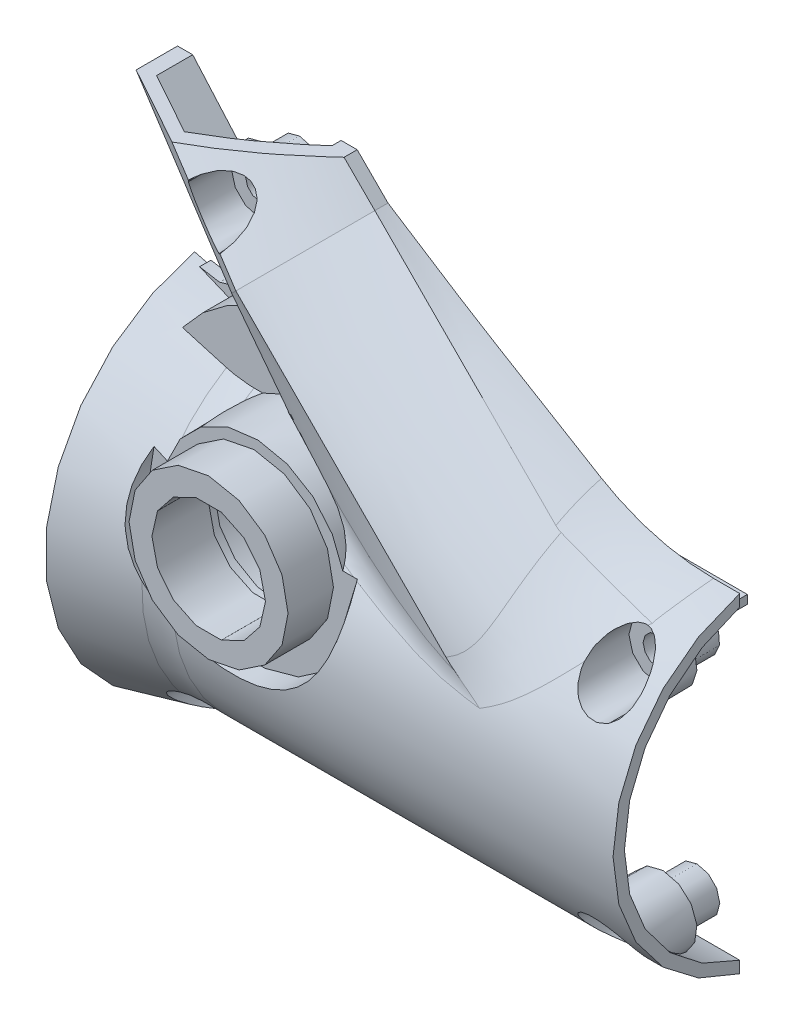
SolidWorks part; units mm, degrees
ref_plane "Plan1" through (0, 0, 0) normal (0, 0, 1) x (1, 0, 0)
ref_plane "Plan2" through (0, 0, 0) normal (0, 1, 0) x (1, 0, 0)
ref_plane "Plan3" through (0, 0, 0) normal (1, 0, 0) x (0, 0, -1)
sketch "Esquisse1" plane through (0, 0, 0) normal (0, 1, 0) x (1, 0, 0)
  line L0 (-80, -50) -> (-80, 50) construction
ref_plane "Plan5" through (-40, 40, 0) normal (-0.7071, 0.7071, 0) x (0, 0, 1)
ref_plane "Plan6" through (-61.2132, 61.2132, 0) normal (-0.7071, 0.7071, 0) x (0, 0, 1)
sketch "Esquisse2" plane through (-61.2132, 61.2132, 0) normal (-0.7071, 0.7071, 0) x (0, 0, 1)
  line L0 (-2.8446, 83.5777) -> (-12.8446, 83.5777)
  line L1 (-1.8446, 73.3764) -> (-13.8446, 73.3764)
  line L2 (-13.8446, 73.3764) -> (-15.3403, 75.977)
  line L3 (-15.3403, 75.977) -> (-12.8446, 83.5777)
  line L4 (-1.8446, 73.3764) -> (-0.3489, 75.977)
  line L5 (-0.3489, 75.977) -> (-2.8446, 83.5777)
  line L6 (-2.8446, 83.5777) -> (-13.8446, 73.3764) construction
  line L7 (-12.8446, 83.5777) -> (-1.8446, 73.3764) construction
  dimension "D1" = 12
  dimension "D2" = 10
  dimension "D3" = 8
  dimension "D4" = 3
  dimension "D5" = 8
  dimension "D6" = 3
sketch "Esquisse3" plane through (-40, 40, 0) normal (-0.7071, 0.7071, 0) x (0, 0, 1)
  line L0 (-2.8446, 83.5777) -> (-12.8446, 83.5777)
  line L1 (-12.8446, 83.5777) -> (-21.218, 78.1109)
  line L2 (-2.8446, 83.5777) -> (5.5288, 78.1109)
  line L3 (5.5288, 78.1109) -> (1.1554, 71.4122)
  line L4 (-21.218, 78.1109) -> (-16.8446, 71.4122)
  line L5 (-16.8446, 71.4122) -> (1.1554, 71.4122)
  line L6 (-2.8446, 83.5777) -> (-16.8446, 71.4122) construction
  line L7 (-12.8446, 83.5777) -> (1.1554, 71.4122) construction
  dimension "D1" = 10
  dimension "D2" = 10
  dimension "D3" = 8
  dimension "D4" = 8
  dimension "D5" = 18
loft "Base-Lissage" add profiles "Esquisse3", "Esquisse2"
ref_plane "Plan7" through (50.07, 0, 0) normal (1, 0, 0) x (0, 0, -1)
ref_plane "Plan8" through (0.07, 0, 0) normal (1, 0, 0) x (0, 0, -1)
sketch "Esquisse5" plane through (0.07, 0, 0) normal (1, 0, 0) x (0, 0, -1)
  circle A0 centre (7.8446, 70.3116) radius 17.5
ref_plane "Plan9" through (-15.2513, 15.2513, 0) normal (-0.7071, 0.7071, 0) x (0, 0, 1)
ref_plane "Plan10" through (10.07, 0, 0) normal (1, 0, 0) x (0, 0, -1)
sketch "Esquisse9" plane through (10.07, 0, 0) normal (1, 0, 0) x (0, 0, -1)
  circle A0 centre (7.8446, 70.3116) radius 15
sketch "Esquisse10" plane through (-40, 40, 0) normal (-0.7071, 0.7071, 0) x (0, 0, 1)
  line L0 (-2.8446, 83.5777) -> (-12.8446, 83.5777)
  line L1 (-2.8446, 83.5777) -> (5.5288, 78.1109)
  line L2 (5.5288, 78.1109) -> (1.1554, 71.4122)
  line L3 (1.1554, 71.4122) -> (-16.8446, 71.4122)
  line L4 (-16.8446, 71.4122) -> (-21.218, 78.1109)
  line L5 (-21.218, 78.1109) -> (-12.8446, 83.5777)
ref_plane "Plan11" through (0, 0, -8) normal (0, 0, 1) x (1, 0, 0)
sketch "Esquisse12" plane through (-15.2513, 15.2513, 0) normal (-0.7071, 0.7071, 0) x (0, 0, 1)
  circle A0 centre (-7.8446, 78.5777) radius 14.1421
  dimension "D1" = 9
  dimension "D2" = 5
loft "Boss.-Lissage1" add profiles "Esquisse12", "Esquisse10"
extrude "Boss.-Extru.2" add sketch "Esquisse9" along normal blind 40
sketch "Esquisse13" plane through (50.07, 0, 0) normal (1, 0, 0) x (0, 0, -1)
  circle A0 centre (7.8446, 70.3116) radius 15.94
extrude "Enlèv. mat.-Extru.1" cut sketch "Esquisse13" along normal blind 50
sketch "Esquisse14" plane through (10.07, 0, 0) normal (-1, 0, 0) x (0, 0, 1)
  circle A0 centre (-7.8446, 70.3116) radius 15
loft "Boss.-Lissage2" add profiles "Esquisse5", "Esquisse14"
fillet "Congé1" radius 10 1 edges at (10.07, 70.3116, 7.1554)
fillet "Congé3" radius 2 1 edges at (14.7265, 86.0336, -17.3)
fillet "Congé5" radius 20 3 edges at (37.8522, 77.0931, 5.5349) (42.6261, 85.2861, -8.7175) (38.4144, 77.6533, -20.925)
fillet "Congé9" radius 3 4 edges at (26.591, 78.6949, -20.2832) (23.0539, 80.0645, 3.5519) (15.967, 83.8004, -17.0589) (36.2035, 75.8986, 6.179)
shell "Coque2" thickness 1
sketch "Esquisse28" plane through (0, 0, -8) normal (0, 0, 1) x (1, 0, 0)
  circle A1 centre (46.3125, 80.3116) radius 2
  circle A2 centre (46.3125, 60.3116) radius 2
  circle A3 centre (11.3125, 98.3116) radius 2
  circle A4 centre (9.3666, 58.3116) radius 2
  circle A5 centre (16.3125, 76.3116) radius 5
  circle A6 centre (46.3125, 80.3116) radius 1.25
  circle A7 centre (46.3125, 60.3116) radius 1.25
  circle A8 centre (9.3666, 58.3116) radius 1.25
  circle A9 centre (11.3125, 98.3116) radius 1.25
extrude "Boss.-Extru.12" add sketch "Esquisse28" along normal up to next and the other way up to next
sketch "Esquisse31" plane through (0, 0, -8) normal (0, 0, 1) x (1, 0, 0)
  line L2 (8.0029, 93.3385) -> (12.9057, 87.9542)
  line L4 (3.5116, 86.9512) -> (13.1986, 82.9294)
  line L5 (13.1986, 82.9294) -> (12.8811, 87.4325)
  line L6 (12.9057, 87.9542) -> (12.8811, 87.4325)
  arc A0 (8.0029, 93.3385) -> (3.5116, 86.9512) centre (5.0453, 90.6454) cw
extrude "Boss.-Extru.18" add sketch "Esquisse31" along normal mid plane 10
sketch "Esquisse34" plane through (0, 0, -8) normal (0, 0, 1) x (1, 0, 0)
  line L0 (15.6094, 89.7932) -> (15.6094, 84.496)
  line L1 (15.6094, 84.496) -> (6.9254, 76.3356)
  line L2 (6.9254, 76.3356) -> (2.9541, 78.2614)
  arc A0 (15.6094, 89.7932) -> (2.9541, 78.2614) centre (16.3125, 76.3116) ccw
  dimension "D1" = 13.5
extrude "Enlèv. mat.-Extru.6" cut sketch "Esquisse34" against normal mid plane 8
ref_plane "Plan15" through (0, 0, -4) normal (0, 0, 1) x (1, 0, 0)
sketch "Esquisse35" plane through (0, 0, -4) normal (0, 0, 1) x (1, 0, 0)
  line L0 (2.07, 22) -> (2.07, 91.4773)
  line L1 (20.1041, 50.6066) -> (-50.6066, -20.1041) construction
  line L2 (2.07, 22) -> (71.4975, 22)
  line L3 (71.4975, 102) -> (-2.1148, 102)
  line L4 (-2.1148, 102) -> (-2.1148, 91.4773)
  line L5 (71.4975, 22) -> (71.4975, 102)
  line L6 (50.07, 55.3116) -> (50.07, 85.3116) construction
  line L7 (-2.1148, 91.4773) -> (2.07, 91.4773)
  dimension "D1" = 80
  dimension "D2" = 22
  dimension "D3" = 48
extrude "Enlèv. mat.-Extru.7" cut sketch "Esquisse35" against normal blind 31
sketch "Esquisse36" plane through (0, 0, -4) normal (0, 0, 1) x (1, 0, 0)
  line L1 (20.07, 121.8105) -> (-9.93, 121.8105)
  line L2 (20.07, 121.8105) -> (20.07, 101.8105)
  line L3 (20.07, 101.8105) -> (-9.93, 101.8105)
  line L4 (-9.93, 121.8105) -> (-9.93, 101.8105)
  line L5 (2.07, 49.8531) -> (-36.7772, 49.8531)
  line L6 (2.07, 49.8531) -> (2.07, 89.736)
  line L7 (2.07, 89.736) -> (-36.7772, 89.736)
  line L8 (-36.7772, 49.8531) -> (-36.7772, 89.736)
  dimension "D1" = 17
  dimension "D2" = 20
  dimension "D3" = 30
  dimension "D4" = 30
extrude "Enlèv. mat.-Extru.8" cut sketch "Esquisse36" against normal mid plane 52
sketch "Esquisse57" plane through (0, 0, -4) normal (0, 0, -1) x (-1, 0, 0)
  line L0 (-15.1291, 90.2615) -> (-15.1291, 83.7329)
  line L1 (-9.5035, 79.4918) -> (-3.9073, 82.8008)
  arc A0 (-3.9073, 82.8008) -> (-15.1291, 90.2615) centre (-16.3125, 76.3116) ccw
  arc A1 (-9.5035, 79.4918) -> (-15.1291, 83.7329) centre (-16.3125, 76.3116) ccw
  dimension "D1" = 14
extrude "Boss.-Extru.33" add sketch "Esquisse57" against normal blind 4
sketch "Esquisse58" plane through (0, 0, -4) normal (0, 0, -1) x (-1, 0, 0)
  line L0 (-15.1291, 90.2615) -> (-15.1291, 83.7329)
  line L1 (-9.5035, 79.4918) -> (-3.9073, 82.8008)
  line L2 (-12.2869, 89.7203) -> (-5.3143, 84.9741)
  arc A0 (-9.5035, 79.4918) -> (-15.1291, 83.7329) centre (-16.3125, 76.3116) ccw
  arc A1 (-3.9073, 82.8008) -> (-5.3143, 84.9741) centre (-16.3125, 76.3116) ccw
  arc A2 (-15.1291, 90.2615) -> (-12.2869, 89.7203) centre (-16.3125, 76.3116) cw
extrude "Enlèv. mat.-Extru.20" cut sketch "Esquisse58" against normal blind 3
sketch "Esquisse38" plane through (0, 0, -4) normal (0, 0, -1) x (-1, 0, 0)
  line L0 (-2.07, 85.8111) -> (-2.07, 54.812)
  line L1 (-2.07, 85.8111) -> (-3.07, 85.5534)
  line L2 (-3.07, 55.0697) -> (-3.07, 68.2564)
  line L3 (-3.07, 55.0697) -> (-2.07, 54.812)
  line L4 (-10.0151, 62.1485) -> (-9.1951, 60.3042)
  line L5 (-10.8181, 61.8181) -> (-10.1812, 60.1382)
  line L6 (-10.1812, 60.1382) -> (-9.1951, 60.3042)
  line L7 (-27.4883, 65.5714) -> (-36.5636, 56.8498)
  line L8 (-50.07, 56.8498) -> (-11.3011, 56.8498) construction
  line L9 (-36.5636, 56.8498) -> (-35.5035, 56.8498)
  line L10 (-35.5035, 56.8498) -> (-26.7766, 64.8768)
  line L11 (-46.1328, 78.3197) -> (-31.6819, 78.3197)
  line L12 (-46.1328, 79.0746) -> (-31.5643, 79.0746)
  line L13 (-46.1328, 79.0746) -> (-46.1328, 78.3197)
  line L14 (-2.07, 70.3116) -> (-8.6332, 70.3116) construction
  line L15 (-11.279, 91.1199) -> (-11.979, 90.1488)
  line L16 (-3.1122, 70.3116) -> (-3.07, 85.5534)
  circle A0 centre (-16.3125, 76.3116) radius 15.5 construction
  arc A1 (-8.5485, 56.4866) -> (-10.714, 56.8335) centre (-9.3666, 58.3116) ccw construction
  arc A2 (-10.8181, 61.8181) -> (-26.7766, 64.8768) centre (-16.3125, 76.3116) cw
  arc A3 (-10.0151, 62.1485) -> (-3.07, 68.2564) centre (-16.3125, 76.3116) ccw
  circle A4 centre (-46.3125, 80.3116) radius 2 construction
  circle A5 centre (-46.3125, 80.3116) radius 1.25 construction
  arc A6 (-27.4883, 65.5714) -> (-31.6819, 78.3197) centre (-16.3125, 76.3116) cw
  arc A7 (-31.5643, 79.0746) -> (-11.279, 91.1199) centre (-16.2878, 76.4516) cw
  arc A8 (-11.979, 90.1488) -> (-3.1122, 70.3116) centre (-16.3125, 76.3116) ccw
  spline S0 degree 3 poles (-2.07, 85.8111) (-3.1515, 85.5325) (-4.233, 85.2535) (-5.3143, 84.9741) knots 0 0 0 0 1 1 1 1 construction
  spline S1 degree 3 poles (-2.07, 54.812) (-4.23, 55.3684) (-6.3895, 55.9264) (-8.5485, 56.4866) knots 0 0 0 0 1 1 1 1 construction
  spline S2 degree 3 poles (-12.2869, 89.7203) (-11.9516, 90.1874) (-11.6157, 90.6539) (-11.279, 91.1199) knots 0 0 0 0 1 1 1 1 construction
  dimension "D1" = 31
  dimension "D4" = 15.5
  dimension "D5" = 15.5
  dimension "D6" = 15.5
  dimension "D7" = 15.5
  dimension "D8" = 14.5
  dimension "D2" = 1
  dimension "D3" = 1
extrude "Boss.-Extru.19" add sketch "Esquisse38" against normal up to next
sketch "Esquisse41" plane through (0, 0, -4) normal (0, 0, -1) x (-1, 0, 0)
  circle A0 centre (-16.3125, 76.3116) radius 9.5
  dimension "D1" = 19
extrude "Boss.-Extru.21" add sketch "Esquisse41" against normal up to next
sketch "Esquisse42" plane through (0, 0, -4) normal (0, 0, -1) x (-1, 0, 0)
  circle A0 centre (-16.3125, 76.3116) radius 9.5
  dimension "D1" = 19
extrude "Enlèv. mat.-Extru.11" cut sketch "Esquisse42" against normal blind 3
sketch "Esquisse43" plane through (0, 0, -1) normal (0, 0, -1) x (-1, 0, 0)
  line L0 (-31.5643, 79.0746) -> (-25.3961, 77.2125)
  line L1 (-31.6819, 78.3197) -> (-25.6785, 76.3116)
  line L2 (-25.6785, 76.3116) -> (-25.3961, 77.2125)
  line L3 (-31.5643, 79.0746) -> (-31.6819, 78.3197)
  line L4 (-26.7766, 64.8768) -> (-22.1082, 69.6607)
  line L5 (-27.4883, 65.5714) -> (-23.2943, 69.8691)
  line L6 (-26.7766, 64.8768) -> (-27.4883, 65.5714)
  line L7 (-22.1082, 69.6607) -> (-22.9033, 70.3116)
  line L8 (-3.07, 85.5534) -> (-3.1122, 70.3116) construction
  line L10 (-6.8679, 77.3361) -> (-3.0956, 77.3361)
  line L11 (-6.8679, 77.3361) -> (-7.3557, 77.3361)
  line L12 (-6.8679, 76.3116) -> (-3.0956, 76.3116)
  line L13 (-7.3557, 77.3361) -> (-7.3557, 76.3116)
  line L14 (-10.2395, 69.4144) -> (-6.7, 65.1)
  line L15 (-16, 85.4) -> (-16, 91.5)
  line L16 (-16, 91.5) -> (-17, 91.5)
  line L17 (-17, 91.5) -> (-17, 85.4)
  line L18 (-17, 85.4) -> (-16, 85.4)
  line L19 (-7.3557, 64.9087) -> (-7.1683, 64.6805)
  line L20 (-7.3557, 64.9087) -> (-10.8593, 69.1746)
  line L21 (-10.8593, 69.1746) -> (-10.2395, 69.4144)
  line L22 (-4.7074, 70.3116) -> (-20.0676, 70.3116) construction
  line L23 (-23.2943, 69.8691) -> (-22.9033, 70.3116)
  line L24 (-7.1683, 64.6805) -> (-6.7, 65.1)
  line L25 (-7.3557, 76.3116) -> (-6.8679, 76.3116)
  line L26 (-3.0956, 77.3361) -> (-2.7783, 77.3361)
  line L27 (-2.7783, 77.3361) -> (-2.7783, 76.3116)
  line L28 (-2.7783, 76.3116) -> (-3.0956, 76.3116)
  arc A0 (-15.1291, 85.7376) -> (-7.7886, 80.5058) centre (-16.3125, 76.3116) ccw construction
  arc A3 (-11.979, 90.1488) -> (-3.1122, 70.3116) centre (-16.3125, 76.3116) ccw construction
extrude "Boss.-Extru.27" add sketch "Esquisse43" against normal up to next
sketch "Esquisse44" plane through (0, 0, -1) normal (0, 0, -1) x (-1, 0, 0)
  circle A0 centre (-16.3125, 76.3116) radius 8
  dimension "D1" = 16
extrude "Boss.-Extru.28" add sketch "Esquisse44" against normal blind 10
sketch "Esquisse45" plane through (0, 0, 9) normal (0, 0, 1) x (1, 0, 0)
  circle A0 centre (16.3, 76.4) radius 9.25
  circle A1 centre (16.3, 76.4) radius 7
  dimension "D1" = 18.5
  dimension "D2" = 14
extrude "Enlèv. mat.-Extru.12" cut sketch "Esquisse45" against normal blind 4
sketch "Esquisse46" plane through (0, 0, -1) normal (0, 0, -1) x (-1, 0, 0)
  circle A0 centre (-16.3125, 76.3116) radius 7
  dimension "D1" = 14
extrude "Enlèv. mat.-Extru.13" cut sketch "Esquisse46" against normal blind 4
sketch "Esquisse47" plane through (0, 0, 3) normal (0, 0, -1) x (-1, 0, 0)
  circle A0 centre (-16.3125, 76.3116) radius 5.5
  dimension "D1" = 11
extrude "Enlèv. mat.-Extru.14" cut sketch "Esquisse47" against normal blind 1
sketch "Esquisse48" plane through (0, 0, 4) normal (0, 0, -1) x (-1, 0, 0)
  circle A0 centre (-16.3125, 76.3116) radius 5
  dimension "D1" = 10
extrude "Enlèv. mat.-Extru.15" cut sketch "Esquisse48" against normal through all
sketch "Esquisse49" plane through (0, 0, -1) normal (0, 0, -1) x (-1, 0, 0)
  line L1 (-17.8125, 84.3116) -> (-14.8125, 84.3116)
  line L2 (-17.8125, 84.3116) -> (-17.8125, 68.3116)
  line L3 (-17.8125, 68.3116) -> (-14.8125, 68.3116)
  line L4 (-14.8125, 84.3116) -> (-14.8125, 68.3116)
  arc A1 (-31.6819, 78.3197) -> (-27.4883, 65.5714) centre (-16.3125, 76.3116) ccw construction
  dimension "D4" = 1.5
  dimension "D1" = 16
  dimension "D2" = 8
  dimension "D3" = 3
extrude "Enlèv. mat.-Extru.16" cut sketch "Esquisse49" against normal blind 1
sketch "Esquisse50" plane through (0, 0, -1) normal (0, 0, -1) x (-1, 0, 0)
  line L4 (-6.9844, 56.4881) -> (-12.1323, 57.1493)
  circle A0 centre (-46.3125, 80.3116) radius 3
  circle A1 centre (-46.3125, 60.3116) radius 3
  arc A2 (-6.9844, 56.4881) -> (-12.1323, 57.1493) centre (-9.3666, 58.3116) ccw
  circle A3 centre (-11.3125, 98.3116) radius 3
  dimension "D1" = 3
  dimension "D2" = 6
extrude "Boss.-Extru.29" add sketch "Esquisse50" against normal up to next
sketch "Esquisse51" plane through (0, 0, 4) normal (0, 0, -1) x (-1, 0, 0)
  circle A0 centre (-46.3125, 80.3116) radius 2.5
  circle A1 centre (-46.3125, 60.3116) radius 2.5
  circle A2 centre (-11.3125, 98.3116) radius 2.5
  circle A3 centre (-9.3666, 58.3116) radius 2.5
  dimension "D1" = 5
  dimension "D2" = 5
  dimension "D3" = 5
  dimension "D4" = 5
extrude "Enlèv. mat.-Extru.17" cut sketch "Esquisse51" against normal mid plane 9
sketch "Esquisse54" plane through (0, 0, -1) normal (0, 0, -1) x (-1, 0, 0)
  circle A0 centre (-46.3125, 80.3116) radius 1.25
  circle A1 centre (-46.3125, 60.3116) radius 1.25
  circle A2 centre (-9.3666, 58.3116) radius 1.25
  circle A3 centre (-11.3125, 98.3116) radius 1.25
extrude "Enlèv. mat.-Extru.18" cut sketch "Esquisse54" against normal mid plane 12.5
sketch "Esquisse55" plane through (0, 0, -4) normal (0, 0, -1) x (-1, 0, 0)
  line L1 (-44.741, 79.0746) -> (-31.6819, 79.0746)
  line L2 (-44.741, 79.0746) -> (-44.741, 78.3197)
  line L3 (-44.741, 78.3197) -> (-31.6819, 78.3197)
  line L4 (-31.6819, 79.0746) -> (-31.6819, 78.3197)
extrude "Boss.-Extru.32" add sketch "Esquisse55" along normal blind 6
sketch "Esquisse56" plane through (2.07, 0, 0) normal (-1, 0, 0) x (0, 0, 1)
  circle A0 centre (-7.8446, 70.3116) radius 7.5
  dimension "D1" = 15
extrude "Enlèv. mat.-Extru.19" cut sketch "Esquisse56" against normal blind 5
